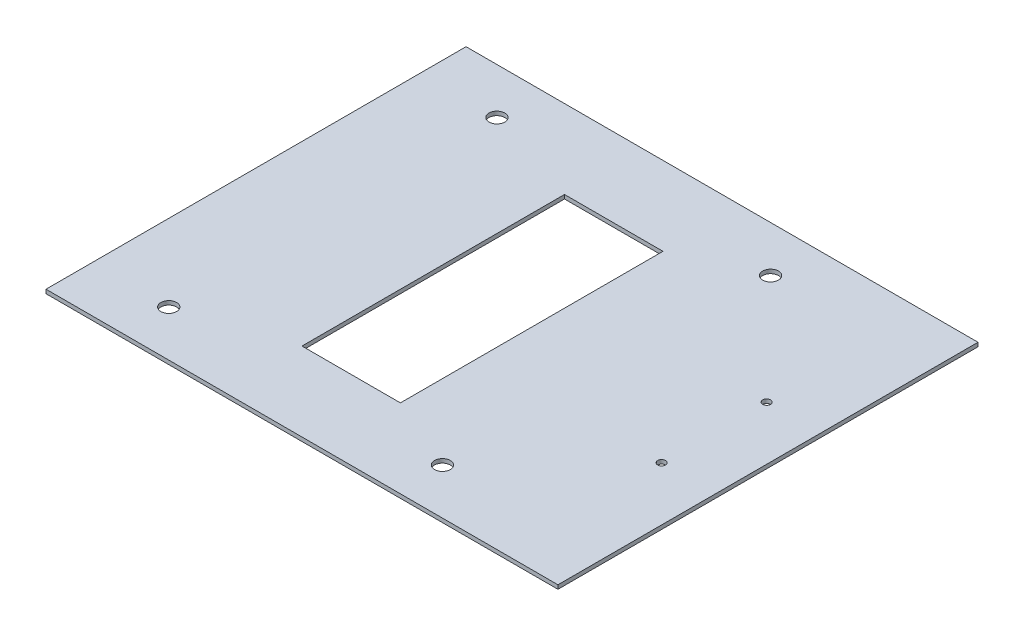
SolidWorks part; units mm, degrees
ref_plane "Plan1" through (0, 0, 0) normal (0, 0, 1) x (1, 0, 0)
ref_plane "Plan2" through (0, 0, 0) normal (0, 1, 0) x (1, 0, 0)
ref_plane "Plan3" through (0, 0, 0) normal (1, 0, 0) x (0, 0, -1)
sketch "Esquisse1" plane through (0, 0, 0) normal (0, 1, 0) x (1, 0, 0)
  line L1 (0, 0) -> (390, 0)
  line L2 (0, 0) -> (0, 320)
  line L3 (0, 320) -> (390, 320)
  line L4 (390, 0) -> (390, 320)
extrude "Base-Extrusion" add sketch "Esquisse1" along normal blind 3
sketch "Esquisse2" plane through (0, 3, 0) normal (0, 1, 0) x (-1, 0, 0)
  line L1 (-135, -60) -> (-210, -60)
  line L2 (-135, -60) -> (-135, -260)
  line L3 (-135, -260) -> (-210, -260)
  line L4 (-210, -60) -> (-210, -260)
extrude "Enlèv. mat.-Extru.1" cut sketch "Esquisse2" against normal blind 4
sketch "Esquisse3" plane through (0, 3, 0) normal (0, 1, 0) x (-1, 0, 0)
  circle A0 centre (-267, -285) radius 6
  circle A1 centre (-58.5, -285) radius 6
  circle A2 centre (-267, -35) radius 6
  circle A3 centre (-58.5, -35) radius 6
extrude "Enlèv. mat.-Extru.2" cut sketch "Esquisse3" against normal blind 4
sketch "Esquisse4" plane through (0, 3, 0) normal (0, 1, 0) x (-1, 0, 0)
  circle A0 centre (-349, -200) radius 3
  circle A1 centre (-349, -120) radius 3
extrude "Enlèv. mat.-Extru.3" cut sketch "Esquisse4" against normal blind 10
